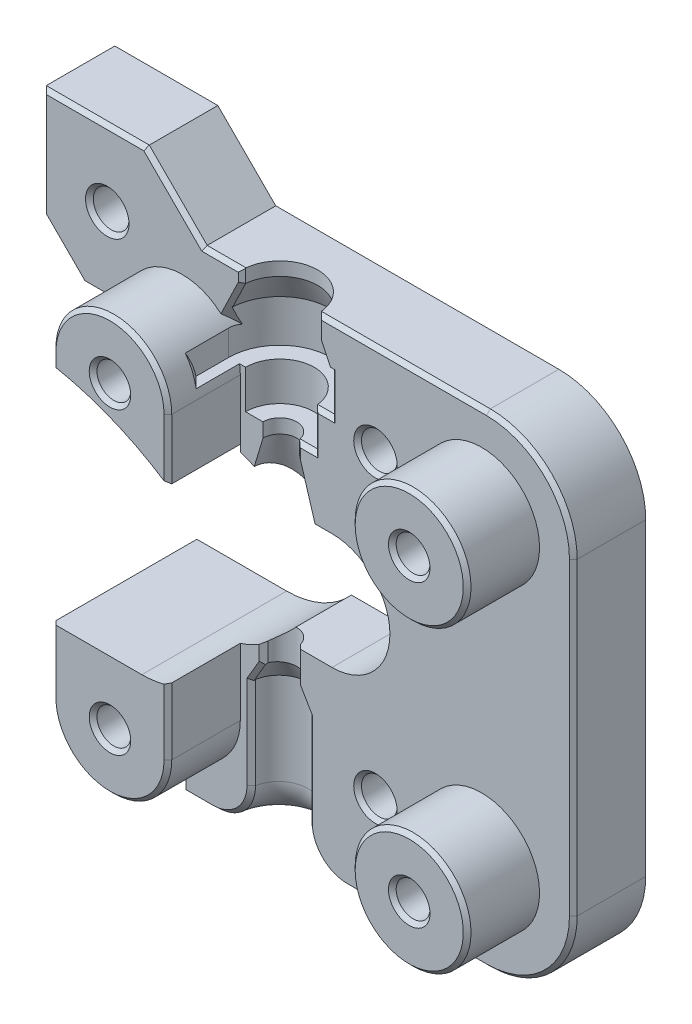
SolidWorks part; units mm, degrees
ref_plane "Front Plane" through (0, 0, 0) normal (0, 0, 1) x (1, 0, 0)
ref_plane "Top Plane" through (0, 0, 0) normal (0, 1, 0) x (1, 0, 0)
ref_plane "Right Plane" through (0, 0, 0) normal (1, 0, 0) x (0, 0, -1)
sketch "Sketch1" plane through (0, 0, 0) normal (0, 0, 1) x (1, 0, 0)
  line L1 (0, 0) -> (50, 0)
  line L2 (0, 0) -> (0, 50)
  line L3 (0, 50) -> (50, 50)
  line L4 (50, 0) -> (50, 50)
  dimension "D1" = 50
  dimension "D2" = 50
extrude "Boss-Extrude1" add sketch "Sketch1" along normal blind 15
sketch "Sketch2" plane through (0, 0, 15) normal (0, 0, 1) x (1, 0, 0)
  line L0 (25, 50) -> (25, 0) construction
  line L1 (50, 50) -> (0, 50) construction
  line L2 (0, 0) -> (50, 0) construction
  line L3 (0, 25) -> (50, 25) construction
  line L4 (0, 50) -> (0, 0) construction
  line L5 (50, 0) -> (50, 50) construction
  circle A0 centre (40.5, 40.5) radius 1.75
  circle A1 centre (9.5, 40.5) radius 1.75
  circle A2 centre (9.5, 9.5) radius 1.75
  circle A3 centre (40.5, 9.5) radius 1.75
  dimension "D1" = 3.5
  dimension "D2" = 3.5
  dimension "D3" = 3.5
  dimension "D4" = 3.5
  dimension "D5" = 15.5
  dimension "D6" = 15.5
  dimension "D7" = 15.5
  dimension "D9" = 15.5
  dimension "D10" = 15.5
  dimension "D11" = 15.5
  dimension "D12" = 15.5
  dimension "D8" = 15.5
extrude "Cut-Extrude1" cut sketch "Sketch2" against normal up to surface (15 mm away)
sketch "Sketch3" plane through (0, 0, 15) normal (0, 0, 1) x (1, 0, 0)
  line L0 (0, 50) -> (50, 0) construction
  circle A0 centre (25, 25) radius 6
  dimension "D1" = 12
extrude "Cut-Extrude2" cut sketch "Sketch3" against normal up to surface (32.7685 mm away)
ref_plane "Plane1" through (0, 0, 15) normal (0, -1, 0) x (-1, 0, 0)
sketch "Sketch4" plane through (0, 50, 0) normal (0, 1, 0) x (1, 0, 0)
  line L0 (50, -7.5) -> (0, -7.5) construction
  line L1 (50, -15) -> (50, 0) construction
  line L2 (0, -15) -> (0, 0) construction
  line L3 (25, 0) -> (25, -15) construction
  line L4 (50, 0) -> (0, 0) construction
  line L5 (50, -15) -> (0, -15) construction
  circle A0 centre (19.6, -7.5) radius 1.75
  dimension "D1" = 5.4
  dimension "D2" = 3.5
extrude "Cut-Extrude3" cut sketch "Sketch4" against normal up to surface (50 mm away)
sketch "Sketch5" plane through (0, 50, 0) normal (0, 1, 0) x (1, 0, 0)
  circle A0 centre (19.6, -7.5) radius 3.925
  dimension "D1" = 7.85
extrude "Cut-Extrude4" cut sketch "Sketch5" against normal blind 1.39
sketch "Sketch6" plane through (0, 48.61, 0) normal (0, 1, 0) x (1, 0, 0)
  circle A0 centre (19.6, -7.5) radius 5.25
  dimension "D1" = 10.5
extrude "Cut-Extrude5" cut sketch "Sketch6" against normal blind 2.75
chamfer "Chamfer1" distance 1.325 distance2 2.75 1 edges at (19.6, 48.61, 12.75)
sketch "Sketch7" plane through (0, 45.86, 0) normal (0, 1, 0) x (1, 0, 0)
  circle A0 centre (19.6, -7.5) radius 5.3006
extrude "Cut-Extrude6" cut sketch "Sketch7" against normal blind 4.4
sketch "Sketch8" plane through (0, 41.46, 0) normal (0, 1, 0) x (1, 0, 0)
  circle A0 centre (19.6, -7.5) radius 3.55
  dimension "D1" = 7.1
extrude "Cut-Extrude7" cut sketch "Sketch8" against normal blind 4
sketch "Sketch21" plane through (0, 0, 15) normal (0, 0, 1) x (1, 0, 0)
  line L0 (25, 31) -> (25, 19)
  line L1 (25, 19) -> (0, 19)
  line L2 (0, 50) -> (0, 0) construction
  line L3 (0, 19) -> (0, 31)
  line L4 (0, 31) -> (25, 31)
  circle A0 centre (25, 25) radius 6 construction
extrude "Cut-Extrude8" cut sketch "Sketch21" against normal through all
chamfer "Chamfer2" distance 1.5 distance2 5 1 edges at (19.6, 31, 9.25)
sketch "Sketch22" plane through (0, 0, 15) normal (0, 0, 1) x (1, 0, 0)
  line L0 (31, 25) -> (0, 25) construction
  line L2 (0, 50) -> (0, 31) construction
  arc A0 (25, 19) -> (25, 31) centre (25, 25) ccw construction
  circle A1 centre (12.8, 25) radius 9
  dimension "D1" = 18
  dimension "D2" = 12.8
extrude "Cut-Extrude9" cut sketch "Sketch22" against normal through all
sketch "Sketch23" plane through (0, 0, 15) normal (0, 0, 1) x (1, 0, 0)
  line L0 (12.8, 34) -> (12.8, 16)
  line L1 (12.8, 16) -> (0, 16)
  line L2 (0, 19) -> (0, 0) construction
  line L3 (0, 16) -> (0, 34)
  line L4 (0, 50) -> (0, 31) construction
  line L5 (0, 34) -> (12.8, 34)
  arc A0 (19.5082, 31) -> (6.0918, 31) centre (12.8, 25) ccw construction
  arc A1 (6.0918, 19) -> (19.5082, 19) centre (12.8, 25) ccw construction
extrude "Cut-Extrude11" cut sketch "Sketch23" against normal through all contours L3 L5 L0 L1
sketch "Sketch24" plane through (0, 0, 15) normal (0, 0, 1) x (1, 0, 0)
  line L0 (40.5, 40.5) -> (9.5, 40.5) construction
  circle A0 centre (29.5, 40.5) radius 1.85
  circle A1 centre (40.5, 40.5) radius 1.75 construction
  dimension "D1" = 3.7
  dimension "D2" = 11
extrude "Cut-Extrude12" cut sketch "Sketch24" against normal through all
sketch "Sketch25" plane through (0, 0, 0) normal (0, 0, -1) x (-1, 0, 0)
  line L1 (-34.1765, 40.5) -> (-31.8383, 36.45)
  line L2 (-31.8383, 36.45) -> (-27.1617, 36.45)
  line L3 (-27.1617, 36.45) -> (-24.8235, 40.5)
  line L4 (-24.8235, 40.5) -> (-27.1617, 44.55)
  line L5 (-27.1617, 44.55) -> (-31.8383, 44.55)
  line L6 (-31.8383, 44.55) -> (-34.1765, 40.5)
  circle A0 centre (-29.5, 40.5) radius 4.05 construction
  dimension "D1" = 8.1
extrude "Cut-Extrude13" cut sketch "Sketch25" against normal blind 4
sketch "Sketch27" plane through (0, 0, 15) normal (0, 0, 1) x (1, 0, 0)
  line L0 (40.5, 9.5) -> (9.5, 9.5) construction
  line L1 (29.5, 40.5) -> (29.5, 9.5) construction
  circle A0 centre (29.5, 9.5) radius 1.85
  dimension "D1" = 3.7
extrude "Cut-Extrude14" cut sketch "Sketch27" against normal through all
sketch "Sketch28" plane through (0, 0, 0) normal (0, 0, -1) x (-1, 0, 0)
  line L1 (-24.8235, 9.5) -> (-27.1617, 13.55)
  line L2 (-27.1617, 13.55) -> (-31.8383, 13.55)
  line L3 (-31.8383, 13.55) -> (-34.1765, 9.5)
  line L4 (-34.1765, 9.5) -> (-31.8383, 5.45)
  line L5 (-31.8383, 5.45) -> (-27.1617, 5.45)
  line L6 (-27.1617, 5.45) -> (-24.8235, 9.5)
  circle A0 centre (-29.5, 9.5) radius 4.05 construction
  dimension "D1" = 8.1
extrude "Cut-Extrude15" cut sketch "Sketch28" against normal up to surface (4 mm away)
sketch "Sketch26" plane through (0, 0, 15) normal (0, 0, 1) x (1, 0, 0)
  line L0 (11.6731, 50) -> (11.6731, 56)
  line L1 (50, 50) -> (0, 50) construction
  line L2 (11.6731, 56) -> (0, 56)
  line L3 (0, 56) -> (0, 50)
  line L13 (12.8, 16) -> (0, 16)
  line L14 (0, 16) -> (0, 0)
  line L15 (0, 0) -> (50, 0)
  line L16 (50, 0) -> (50, 50)
  line L17 (50, 50) -> (0, 50)
  line L18 (0, 50) -> (0, 34)
  line L19 (0, 34) -> (12.8, 34)
  line L20 (19.5082, 31) -> (25, 31)
  line L21 (25, 19) -> (19.5082, 19)
  line L26 (11.6731, 50) -> (0, 50)
  arc A3 (19.5082, 31) -> (12.8, 34) centre (12.8, 25) ccw
  arc A4 (25, 19) -> (25, 31) centre (25, 25) ccw
  arc A5 (12.8, 16) -> (19.5082, 19) centre (12.8, 25) ccw
  dimension "D2" = 6
  dimension "D1" = 0
extrude "Boss-Extrude5" add sketch "Sketch26" against normal up to surface (15 mm away)
sketch "Sketch29" plane through (0, 0, 0) normal (0, 0, -1) x (-1, 0, 0)
  line L0 (0, 34) -> (0, 56)
  line L1 (0, 56) -> (5, 56)
  line L2 (5, 56) -> (5, 34)
  line L3 (5, 34) -> (0, 34)
  dimension "D1" = 5
extrude "Boss-Extrude6" add sketch "Sketch29" against normal up to surface (15 mm away)
sketch "Sketch30" plane through (0, 0, 15) normal (0, 0, 1) x (1, 0, 0)
  line L0 (9.5, 40.5) -> (9.5, 56) construction
  line L1 (11.6731, 56) -> (-5, 56) construction
  line L2 (9.5, 40.5) -> (-5, 55) construction
  line L3 (-5, 56) -> (-5, 34) construction
  circle A0 centre (1.7218, 48.2782) radius 1.85
  circle A1 centre (9.5, 40.5) radius 1.75 construction
  dimension "D2" = 3.7
  dimension "D3" = 11
  dimension "D4" = 7.7782
  dimension "D1" = 45
extrude "Cut-Extrude16" cut sketch "Sketch30" against normal through all
sketch "Sketch31" plane through (0, 0, 0) normal (0, 0, -1) x (-1, 0, 0)
  line L1 (-6.3984, 48.2782) -> (-4.0601, 44.2282)
  line L2 (-4.0601, 44.2282) -> (0.6164, 44.2282)
  line L3 (0.6164, 44.2282) -> (2.9547, 48.2782)
  line L4 (2.9547, 48.2782) -> (0.6164, 52.3282)
  line L5 (0.6164, 52.3282) -> (-4.0601, 52.3282)
  line L6 (-4.0601, 52.3282) -> (-6.3984, 48.2782)
  circle A0 centre (-1.7218, 48.2782) radius 4.05 construction
  dimension "D1" = 8.1
extrude "Cut-Extrude17" cut sketch "Sketch31" against normal up to surface (4 mm away)
sketch "Sketch32" plane through (0, 0, 0) normal (-1, 0, 0) x (0, 0, 1)
  line L0 (15, 16) -> (15, 0) construction
  line L1 (0, 16) -> (15, 16)
  line L2 (0, 16) -> (0, 0)
  line L3 (0, 0) -> (15, 0)
  line L4 (15, 16) -> (15, 0)
extrude "Boss-Extrude7" add sketch "Sketch32" along normal up to surface (5 mm away)
sketch "Sketch33" plane through (0, 0, 15) normal (0, 0, 1) x (1, 0, 0)
  line L0 (3.5, 16) -> (3.5, 9.5)
  line L1 (12.8, 16) -> (-5, 16) construction
  line L2 (9.5, 9.5) -> (9.5, 0) construction
  line L3 (-5, 0) -> (50, 0) construction
  line L4 (3.5, 16) -> (-5, 16)
  line L5 (-5, 0) -> (-5, 16) construction
  line L6 (-5, 16) -> (-5, 0)
  line L7 (-5, 0) -> (50, 0)
  line L8 (50, 0) -> (50, 50)
  line L9 (3.5, 9.5) -> (50, 9.5) construction
  line L10 (15.5, 9.5) -> (15.5, 16.4145)
  line L11 (15.5, 16.4145) -> (19.5082, 19)
  line L12 (19.5082, 19) -> (25, 19)
  line L13 (25, 31) -> (19.5082, 31) construction
  line L14 (40.5, 40.5) -> (-5, 40.5) construction
  line L15 (-5, 56) -> (-5, 34) construction
  line L16 (3.5, 40.5) -> (3.5, 34)
  line L17 (-5, 34) -> (12.8, 34) construction
  line L18 (15.5, 40.5) -> (15.5, 33.5855)
  line L19 (15.5, 33.5855) -> (19.5082, 31)
  line L20 (19.5082, 31) -> (25, 31)
  line L21 (3.5, 34) -> (-5, 34)
  line L22 (-5, 34) -> (-5, 56)
  line L23 (-5, 56) -> (11.6731, 56)
  line L24 (11.6731, 56) -> (11.6731, 50)
  line L25 (11.6731, 50) -> (50, 50)
  arc A0 (3.5, 9.5) -> (9.5, 3.5) centre (9.5, 9.5) ccw
  circle A1 centre (9.5, 9.5) radius 1.75 construction
  circle A2 centre (40.5, 9.5) radius 6
  arc A3 (9.5, 3.5) -> (15.5, 9.5) centre (9.5, 9.5) ccw
  arc A4 (12.8, 16) -> (19.5082, 19) centre (12.8, 25) ccw construction
  arc A5 (25, 19) -> (25, 31) centre (25, 25) ccw
  circle A6 centre (40.5, 40.5) radius 6
  arc A7 (3.5, 40.5) -> (15.5, 40.5) centre (9.5, 40.5) cw
  arc A8 (19.5082, 31) -> (12.8, 34) centre (12.8, 25) ccw construction
  dimension "D1" = 6
  dimension "D2" = 12
  dimension "D3" = 12
  dimension "D4" = 6
extrude "Cut-Extrude18" cut sketch "Sketch33" against normal blind 7.5
sketch "Sketch34" plane through (0, 0, 15) normal (0, 0, 1) x (1, 0, 0)
  line L0 (14.2994, 44.1008) -> (14.2994, 41.46)
  line L1 (14.2994, 41.46) -> (15.4227, 41.46)
  line L2 (15.4227, 41.46) -> (15.4227, 44.1008)
  line L3 (15.4227, 44.1008) -> (14.2994, 44.1008)
extrude "Cut-Extrude19" cut sketch "Sketch34" against normal up to surface (7.5 mm away)
sketch "Sketch35" plane through (0, 0, 7.5) normal (0, 0, 1) x (1, 0, 0)
  line L0 (3.5, 16) -> (3.5, 0) construction
  line L1 (-5, 0) -> (17.85, 0) construction
  line L2 (3.5, 0) -> (-5, 16) construction
  circle A0 centre (-0.75, 8) radius 1.85
  dimension "D1" = 3.7
extrude "Cut-Extrude20" cut sketch "Sketch35" against normal through all
sketch "Sketch39" plane through (0, 0, 7.5) normal (0, 0, 1) x (1, 0, 0)
  line L0 (3.5, 34) -> (3.5, 40.5)
  line L1 (3.5, 40.5) -> (-0.75, 40.5)
  line L2 (-0.75, 40.5) -> (-5, 44.75)
  line L3 (-5, 56) -> (-5, 34) construction
  line L4 (-5, 44.75) -> (-5, 34)
  line L5 (-5, 34) -> (3.5, 34)
  dimension "D1" = 8.5
  dimension "D2" = 4.25
  dimension "D3" = 45
extrude "Cut-Extrude23" cut sketch "Sketch39" against normal through all
sketch "Sketch40" plane through (0, 0, 7.5) normal (0, 0, 1) x (1, 0, 0)
  line L0 (3.5, 16) -> (3.5, 9.5)
  line L1 (3.5, 16) -> (-5, 16)
  line L2 (-5, 16) -> (-5, 0)
  line L3 (9.5, 0) -> (-5, 0)
  line L4 (-5, 0) -> (17.85, 0) construction
  line L5 (9.5, 0) -> (9.5, 3.5)
  arc A0 (3.5, 9.5) -> (15.5, 9.5) centre (9.5, 9.5) ccw construction
  arc A1 (3.5, 9.5) -> (9.5, 3.5) centre (9.5, 9.5) ccw
extrude "Cut-Extrude25" cut sketch "Sketch40" against normal through all
sketch "Sketch41" plane through (0, 0, 15) normal (0, 0, 1) x (1, 0, 0)
  line L2 (15.5, 34.2702) -> (15.5, 33.5855)
  line L3 (15.5, 33.5855) -> (3.5, 34)
  line L4 (3.5, 34) -> (3.5, 39.1789)
  arc A0 (15.5, 34.2702) -> (3.5, 39.1789) centre (-2.25, 8) ccw
extrude "Cut-Extrude26" cut sketch "Sketch41" against normal through all
chamfer "Chamfer3" distance 6 angle 45 1 edges at (11.6731, 56, 3.75)
fillet "Fillet2" radius 9 2 edges at (50, 0, 3.75) (50, 50, 3.75)
sketch "Sketch43" plane through (0, 0, 15) normal (0, 0, 1) x (1, 0, 0)
  line L0 (15.4227, 41.46) -> (14.2994, 41.46)
  line L1 (14.2994, 41.46) -> (14.2994, 44.1008)
  arc A0 (14.2994, 44.1008) -> (15.4227, 41.46) centre (9.5, 40.5) cw
  arc A1 (15.5, 40.5) -> (15.4227, 41.46) centre (9.5, 40.5) ccw construction
extrude "Boss-Extrude9" add sketch "Sketch43" against normal blind 5
chamfer "Chamfer4" distance 2 angle 45 1 edges at (15.0213, 42.8486, 10)
chamfer "Chamfer5" distance 0.4 angle 45 7 edges at (42.25, 40.5, 15) (11.25, 9.5, 15) (42.25, 9.5, 15) (27.65, 9.5, 7.5) (11.25, 40.5, 15) (27.65, 40.5, 7.5) (-0.1282, 48.2782, 7.5)
chamfer "Chamfer7" distance 0.4 angle 45 8 edges at (3.5, 39.8395, 15) (15.5, 37.3851, 15) (9.5, 46.5, 15) (46.5, 40.5, 15) (46.5, 9.5, 15) (3.5, 12.75, 15) (9.5, 3.5, 15) (15.5, 12.9573, 15)
chamfer "Chamfer8" distance 0.4 angle 45 6 edges at (24.9006, 43.66, 7.5) (24.0253, 41.46, 7.5) (23.15, 39.46, 7.5) (22.25, 37.46, 7.5) (21.35, 36.73, 7.5) (22.1, 33.5, 7.5)
chamfer "Chamfer9" distance 0.4 angle 45 3 edges at (-5, 50.375, 7.5) (-2.875, 42.625, 7.5) (1.375, 40.5, 7.5)
sketch "Sketch44" plane through (0, 0, 0) normal (0, -1, 0) x (1, 0, 0)
  circle A0 centre (19.6, 7.6045) radius 3
  dimension "D1" = 6
extrude "Cut-Extrude27" cut sketch "Sketch44" against normal offset from surface (17 mm away) 2
chamfer "Chamfer10" distance 2 angle 60 1 edges at (20.2452, 17, 4.6747)
fillet "Fillet3" radius 4 1 edges at (19.6, 0, 4.6045)
chamfer "Chamfer11" distance 0.4 angle 45 21 edges at (11.0504, 0, 7.5) (15.1003, 0.8768, 7.5) (23.5956, 1.3577, 7.5) (16.6018, 8.7679, 7.5) (22.5982, 8.7679, 7.5) (17.85, 16.6229, 7.5) (21.35, 17.3478, 7.5) (33.7996, 0, 7.5) (32.2625, 50, 7.5) (47.364, 2.636, 7.5) (47.364, 47.364, 7.5) (50, 25, 7.5) (0.5365, 56, 7.5) (8.6731, 53, 7.5) (13.674, 50, 7.5) (9.5, 1.75, 7.5) (15.675, 49.305, 7.5) (23.525, 49.305, 7.5) (15.0125, 47.235, 7.5)
equation "\"D2@Sketch2\"=\"D1@Sketch2\""
equation "\"D3@Sketch2\"=\"D1@Sketch2\""
equation "\"D4@Sketch2\"=\"D1@Sketch2\""
equation "\"D6@Sketch2\"=\"D5@Sketch2\""
equation "\"D12@Sketch2\"=\"D11@Sketch2\""
equation "\"D9@Sketch2\"=\"D8@Sketch2\""
equation "\"D10@Sketch2\"=\"D7@Sketch2\""
equation "\"D3@Chamfer1\"=\"D1@Cut-Extrude5\""
equation "\"D1@Chamfer1\"=(\"D1@Sketch6\"-\"D1@Sketch5\")/2"
equation "\"D1@Sketch28\"=\"D1@Sketch25\""
equation "\"D1@Sketch27\"=\"D1@Sketch24\""
equation "\"D2@Sketch30\"=\"D1@Sketch24\""
equation "\"D1@Sketch31\"=\"D1@Sketch25\""
equation "\"D3@Sketch33\"=\"D2@Sketch33\""
equation "\"D1@Sketch35\"=\"D1@Sketch24\""
